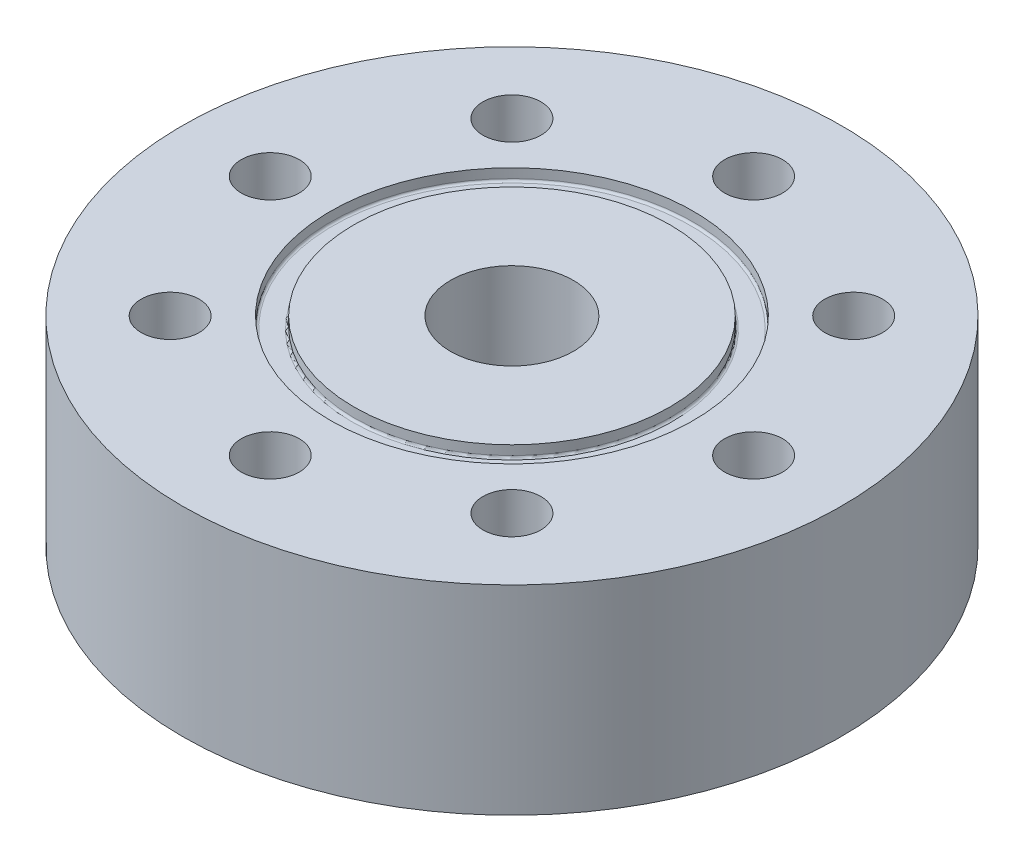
SolidWorks part; units mm, degrees
ref_plane "Front Plane" through (0, 0, 0) normal (0, 0, 1) x (1, 0, 0)
ref_plane "Top Plane" through (0, 0, 0) normal (0, 1, 0) x (1, 0, 0)
ref_plane "Right Plane" through (0, 0, 0) normal (1, 0, 0) x (0, 0, -1)
sketch "Sketch2" plane through (0, 0, 0) normal (0, 1, 0) x (1, 0, 0)
  circle A0 centre (0, 0) radius 37.5
  dimension "D1" = 75
extrude "Outer Cylinder" add sketch "Sketch2" along normal blind 22.7
sketch "Sketch3" plane through (0, 0, 0) normal (0, -1, 0) x (1, 0, 0)
  circle A0 centre (0, 0) radius 8.93
  dimension "D1" = 17.86
extrude "NPT Hole" cut sketch "Sketch3" against normal blind 12.7
sketch "Sketch4" plane through (0, 0, 0) normal (0, -1, 0) x (1, 0, 0)
  circle A0 centre (-27.5, 0) radius 3.3
  circle A1 centre (-19.4454, 19.4454) radius 3.3
  circle A2 centre (0, 27.5) radius 3.3
  circle A3 centre (19.4454, 19.4454) radius 3.3
  circle A4 centre (27.5, 0) radius 3.3
  circle A5 centre (19.4454, -19.4454) radius 3.3
  circle A6 centre (0, -27.5) radius 3.3
  circle A7 centre (-19.4454, -19.4454) radius 3.3
  point P19 (0, 0)
  dimension "D1" = 6.6
  dimension "D2" = 27.5
  dimension "D3" = 8
extrude "Bolt Holes" cut sketch "Sketch4" against normal through all
sketch "Sketch5" plane through (0, 22.7, 0) normal (0, 1, 0) x (1, 0, 0)
  circle A0 centre (0, 0) radius 17.9705
  circle A1 centre (0, 0) radius 20.6375
  dimension "D1" = 41.275
  dimension "D2" = 2.667
extrude "O-Ring Groove" cut sketch "Sketch5" against normal blind 1.3208
fillet "Fillet1" radius 0.254 2 edges at (0, 21.3792, 17.9705) (0, 21.3792, 20.6375)
sketch "Sketch6" plane through (0, 22.7, 0) normal (0, 1, 0) x (1, 0, 0)
  circle A0 centre (0, 0) radius 7
extrude "Inlet Flow Diameter" cut sketch "Sketch6" against normal blind 10
equation "\"D\"= 14"
equation "\"Inlet Flow Diameter\"= \"D\""
equation "\"D1@Sketch6\"=\"D\""
